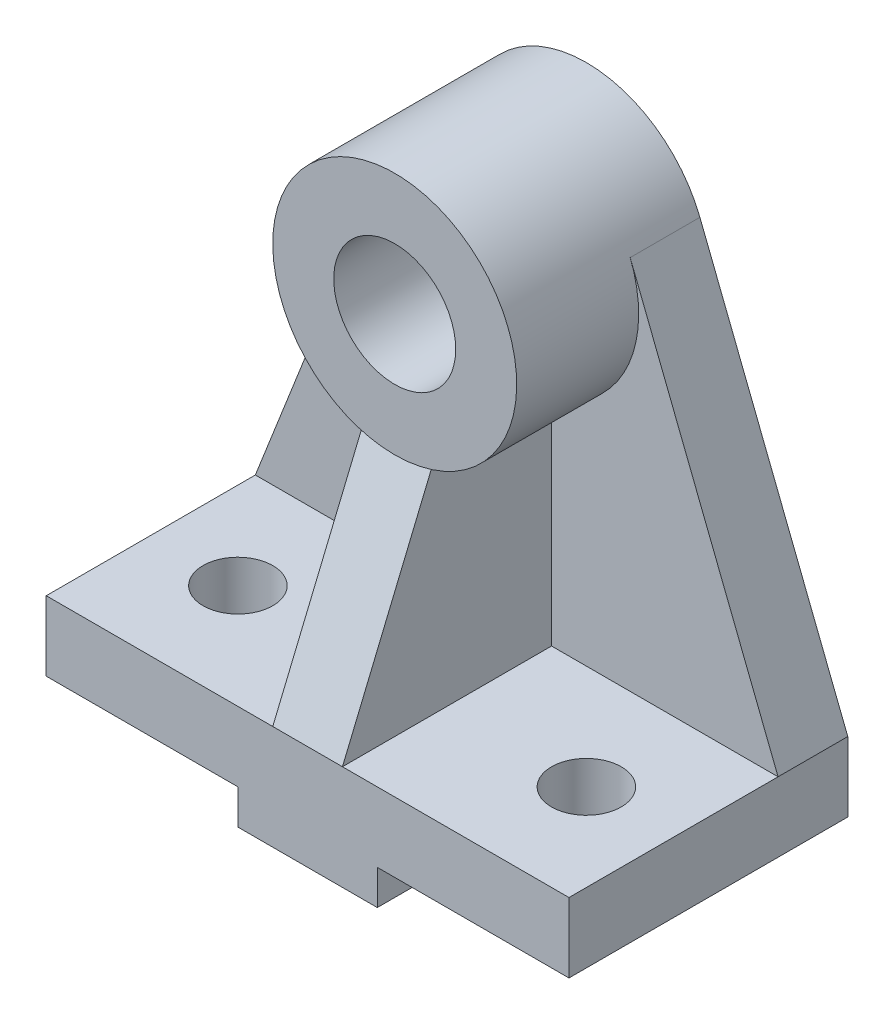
SolidWorks part; units mm, degrees
ref_plane "Front Plane" through (0, 0, 0) normal (0, 0, 1) x (1, 0, 0)
ref_plane "Top Plane" through (0, 0, 0) normal (0, 1, 0) x (1, 0, 0)
ref_plane "Right Plane" through (0, 0, 0) normal (1, 0, 0) x (0, 0, -1)
sketch "Sketch1" plane through (0, 0, 0) normal (0, 0, 1) x (1, 0, 0)
  line L0 (-75, 0) -> (75, 0)
  line L1 (75, 0) -> (75, -20)
  line L2 (75, -20) -> (20, -20)
  line L3 (20, -20) -> (20, -30)
  line L4 (20, -30) -> (-20, -30)
  line L5 (-20, -30) -> (-20, -20)
  line L6 (-20, -20) -> (-75, -20)
  line L7 (-75, -20) -> (-75, 0)
  line L8 (0, 0) -> (0, 35.7308) construction
  dimension "D1" = 150
  dimension "D2" = 20
  dimension "D3" = 40
  dimension "D4" = 10
extrude "Boss-Extrude1" add sketch "Sketch1" along normal blind 80
sketch "Sketch5" plane through (0, 0, 0) normal (0, 0, -1) x (-1, 0, 0)
  line L0 (-75, 0) -> (-32.5686, 107.8173)
  line L1 (75, 0) -> (32.5686, 107.8173)
  line L2 (-75, 0) -> (75, 0)
  arc A0 (-32.5686, 107.8173) -> (32.5686, 107.8173) centre (0, 95) cw
  dimension "D1" = 35
  dimension "D2" = 95
extrude "Boss-Extrude4" add sketch "Sketch5" against normal blind 20
sketch "Sketch6" plane through (0, 0, 20) normal (0, 0, 1) x (1, 0, 0)
  circle A0 centre (0, 95) radius 35
  arc A1 (32.5686, 107.8173) -> (-32.5686, 107.8173) centre (0, 95) ccw construction
extrude "Boss-Extrude5" add sketch "Sketch6" along normal blind 35
sketch "Sketch7" plane through (0, 0, 55) normal (0, 0, 1) x (1, 0, 0)
  circle A0 centre (0, 95) radius 17.5
  dimension "D1" = 35
extrude "Cut-Extrude2" cut sketch "Sketch7" against normal through all
sketch "Sketch8" plane through (0, 0, 0) normal (1, 0, 0) x (0, 0, -1)
  line L0 (-55, 60) -> (-80, 0)
rib "Rib1" sketch "Sketch8" sketch "Sketch8" thickness 20 extrusion direction parallel to sketch draft on no parameters "D1"=20
sketch "Sketch9" plane through (0, 0, 0) normal (0, 1, 0) x (1, 0, 0)
  line L0 (-75, -80) -> (-75, -20) construction
  line L1 (-10, -80) -> (-75, -80) construction
  circle A0 centre (50, -50) radius 10
  circle A1 centre (-50, -50) radius 10
  dimension "D1" = 20
  dimension "D2" = 100
  dimension "D3" = 25
  dimension "D4" = 30
extrude "Cut-Extrude3" cut sketch "Sketch9" against normal through all
